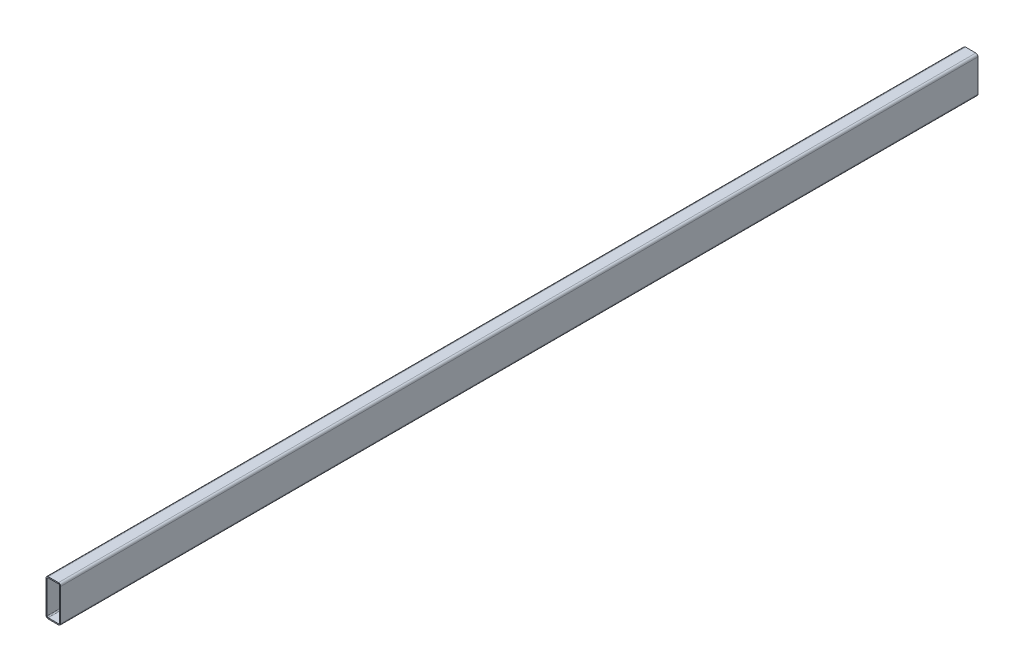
SolidWorks part; units mm, degrees
ref_plane "Plan1" through (0, 0, 0) normal (0, 0, 1) x (1, 0, 0)
ref_plane "Plan2" through (0, 0, 0) normal (0, 1, 0) x (1, 0, 0)
ref_plane "Plan3" through (0, 0, 0) normal (1, 0, 0) x (0, 0, -1)
sketch "Esquisse1" plane through (0, 0, 0) normal (0, 0, 1) x (1, 0, 0)
  line L1 (6, 0) -> (34, 0)
  line L2 (0, 6) -> (0, 94)
  line L3 (6, 100) -> (34, 100)
  line L4 (40, 6) -> (40, 94)
  line L5 (6, 3) -> (34, 3)
  line L6 (3, 6) -> (3, 94)
  line L7 (6, 97) -> (34, 97)
  line L8 (37, 6) -> (37, 94)
  arc A0 (6, 97) -> (3, 94) centre (6, 94) ccw
  arc A1 (37, 94) -> (34, 97) centre (34, 94) ccw
  arc A2 (34, 3) -> (37, 6) centre (34, 6) ccw
  arc A3 (3, 6) -> (6, 3) centre (6, 6) ccw
  arc A4 (0, 94) -> (6, 100) centre (6, 94) cw
  arc A5 (40, 94) -> (34, 100) centre (34, 94) ccw
  arc A6 (34, 0) -> (40, 6) centre (34, 6) ccw
  arc A7 (0, 6) -> (6, 0) centre (6, 6) ccw
  point P15 (37, 3)
  point P18 (3, 3)
  point P21 (0, 100)
  point P26 (40, 0)
  point P29 (0, 0)
  dimension "D7" = 3
  dimension "D8" = 6
  dimension "D1" = 100
  dimension "D2" = 40
  dimension "D3" = 3
  dimension "D4" = 3
  dimension "D5" = 3
  dimension "D6" = 34
extrude "Extrusion1" add sketch "Esquisse1" along normal blind 2500
